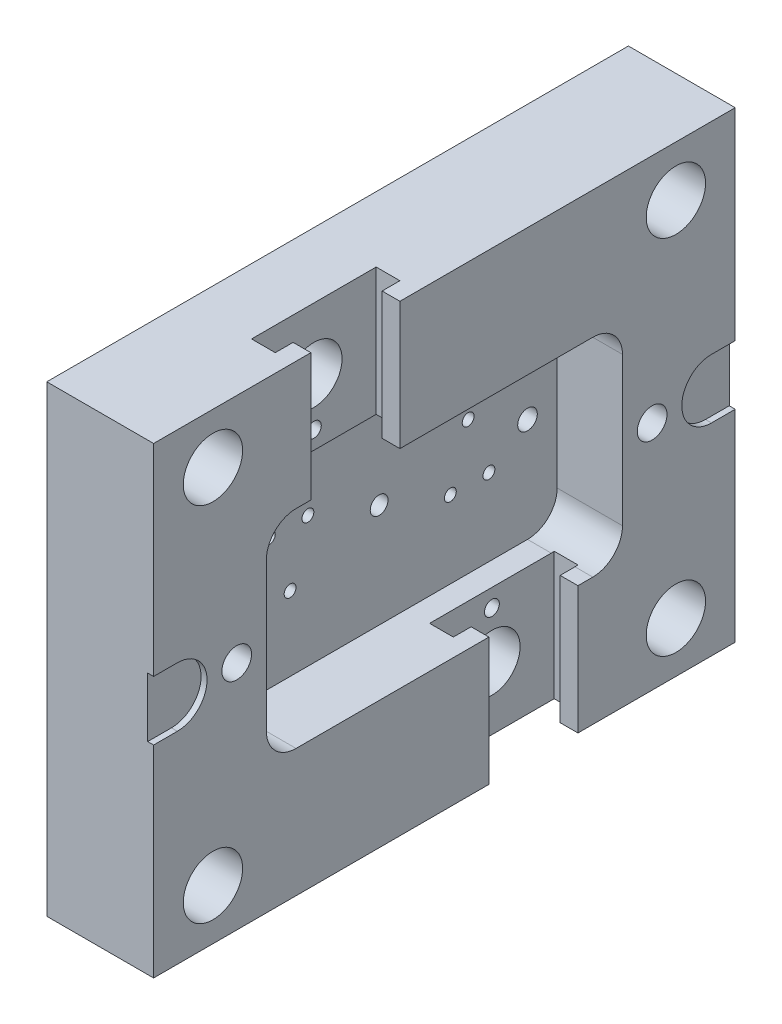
SolidWorks part; units mm, degrees
ref_plane "Face" through (0, 0, 0) normal (0, 0, 1) x (1, 0, 0)
ref_plane "Dessus" through (0, 0, 0) normal (0, 1, 0) x (1, 0, 0)
ref_plane "Droite" through (0, 0, 0) normal (1, 0, 0) x (0, 0, -1)
imported_body "Importée1"
sketch "Esquisse2" plane through (-75, 0, 0) normal (-1, 0, 0) x (0, 0, 1)
  line L0 (0, 156) -> (196, 156) construction
  line L1 (0, 0) -> (0, 156) construction
  circle A0 centre (98, 78) radius 3
  dimension "D1" = 6
  dimension "D2" = 78
  dimension "D3" = 98
extrude "Enlèv. mat.-Extru.1" cut sketch "Esquisse2" against normal through all
sketch "Esquisse1" plane through (-39, 0, 0) normal (-1, 0, 0) x (0, 0, 1)
  line L1 (48, 113) -> (148, 113)
  line L2 (38, 103) -> (38, 53)
  line L3 (48, 43) -> (148, 43)
  line L4 (158, 103) -> (158, 53)
  arc A0 (148, 43) -> (158, 53) centre (148, 53) ccw
  arc A1 (148, 113) -> (158, 103) centre (148, 103) cw
  arc A2 (48, 113) -> (38, 103) centre (48, 103) ccw
  arc A3 (38, 53) -> (48, 43) centre (48, 53) ccw
  circle A4 centre (98, 78) radius 3 construction
  point P8 (158, 113)
  point P11 (38, 113)
  point P14 (38, 43)
  dimension "D3" = 10
  dimension "D1" = 120
  dimension "D2" = 70
  dimension "D4" = 60
  dimension "D5" = 35
extrude "Enlèv. mat.-Extru.2" cut sketch "Esquisse1" along normal blind 22
sketch "Esquisse3" plane through (0, 156, 0) normal (0, 1, 0) x (-1, 0, 0)
  line L0 (39, 143) -> (39, 113)
  line L1 (39, 196) -> (39, 0) construction
  line L2 (39, 143) -> (45, 143)
  line L3 (45, 143) -> (45, 149)
  line L4 (45, 149) -> (53, 149)
  line L5 (53, 149) -> (53, 107)
  line L6 (53, 107) -> (45, 107)
  line L7 (45, 107) -> (45, 113)
  line L8 (45, 113) -> (39, 113)
  line L9 (61, 98) -> (75, 98) construction
  dimension "D1" = 30
  dimension "D2" = 8
  dimension "D3" = 6
  dimension "D4" = 6
  dimension "D5" = 15
extrude "Enlèv. mat.-Extru.3" cut sketch "Esquisse3" against normal up to next
sketch "Esquisse4" plane through (0, 0, 0) normal (0, -1, 0) x (1, 0, 0)
  line L0 (-39, 53) -> (-39, 83)
  line L1 (-39, 0) -> (-39, 196) construction
  line L2 (-39, 83) -> (-45, 83)
  line L3 (-45, 83) -> (-45, 89)
  line L4 (-45, 89) -> (-53, 89)
  line L5 (-53, 89) -> (-53, 47)
  line L6 (-53, 47) -> (-45, 47)
  line L7 (-45, 47) -> (-45, 53)
  line L8 (-45, 53) -> (-39, 53)
  line L9 (-61, 98) -> (-75, 98) construction
  dimension "D1" = 8
  dimension "D2" = 6
  dimension "D3" = 6
  dimension "D4" = 30
  dimension "D5" = 15
extrude "Enlèv. mat.-Extru.4" cut sketch "Esquisse4" against normal up to next
hole_wizard "Trou taraudé M10x1.51" positions "Esquisse6" profile "Esquisse5" tap size "M10x1.5" standard "Ansi Métrique"
sketch "Esquisse6" plane through (-75, 0, 0) normal (-1, 0, 0) x (0, 0, 1)
  point P0 (41, 17)
  point P1 (41, 139)
  point P2 (155, 139)
  point P4 (155, 17)
sketch "Esquisse5" plane through (-75, 17, 41) normal (0, 1, 0) x (0, 0, 1)
  line L0 (0, 0) -> (0, 30.0537)
  line L1 (0, 30.0537) -> (4.25, 27.5)
  line L2 (4.25, 27.5) -> (4.25, 0)
  line L5 (4.25, 0) -> (0, 0)
  line L10 (0, 30.0537) -> (-4.25, 27.5) construction
  line L11 (0, -6.35) -> (0, 107.95) construction
  dimension "Diamètre du trou pour taraudage" = 8.5
  dimension "Profondeur du trou pour taraudage" = 27.5
  dimension "Angle de pointe" = 118
sketch "Esquisse7" plane through (-61, 0, 0) normal (1, 0, 0) x (0, 0, -1)
  circle A0 centre (-135, 87) radius 2
  circle A1 centre (-122, 87) radius 2
  circle A2 centre (-128, 68) radius 2
  circle A3 centre (-68, 88) radius 2
  circle A4 centre (-74, 69) radius 2
  circle A5 centre (-61, 69) radius 2
  dimension "D1" = 4
  dimension "D2" = 10
  dimension "D3" = 9
  dimension "D4" = 24
  dimension "D5" = 10
  dimension "D6" = 9
  dimension "D7" = 37
  dimension "D8" = 30
  dimension "D9" = 9
  dimension "D10" = 24
  dimension "D11" = 30
  dimension "D12" = 37
extrude "Enlèv. mat.-Extru.5" cut sketch "Esquisse7" against normal through all
hole_wizard "Dégagement M101" positions "Esquisse10" profile "Esquisse9" hole size "M10" standard "Ansi Métrique"
sketch "Esquisse10" plane through (0, 0, 0) normal (0, 0, -1) x (-1, 0, 0)
  line L0 (75, 0) -> (75, 156) construction
  line L1 (61, 78) -> (75, 78) construction
  point P0 (68, 98)
  point P5 (68, 58)
  dimension "D1" = 7
  dimension "D2" = 20
  dimension "D3" = 20
sketch "Esquisse9" plane through (-68, 98, 0) normal (1, 0, 0) x (0, 1, 0)
  line L0 (0, 0) -> (0, 122.4034)
  line L1 (0, 122.4034) -> (4, 120)
  line L2 (4, 120) -> (4, 0)
  line L5 (4, 0) -> (0, 0)
  line L10 (0, 122.4034) -> (-4, 120) construction
  line L11 (0, -6.35) -> (0, 107.95) construction
  dimension "Diamètre du perçage" = 8
  dimension "Profondeur du perçage" = 120
  dimension "Angle de pointe" = 118
hole_wizard "Dégagement M102" positions "Esquisse12" profile "Esquisse11" hole size "M10" standard "Ansi Métrique"
sketch "Esquisse12" plane through (0, 0, 0) normal (0, -1, 0) x (1, 0, 0)
  line L0 (-68, 120) -> (-68, 0) construction
  line L1 (-61, 98) -> (-75, 98) construction
  point P0 (-68, 114)
  dimension "D1" = 16
sketch "Esquisse11" plane through (-68, 0, 114) normal (1, 0, 0) x (0, 0, -1)
  line L0 (0, 0) -> (0, 107.4034)
  line L1 (0, 107.4034) -> (4, 105)
  line L2 (4, 105) -> (4, 0)
  line L5 (4, 0) -> (0, 0)
  line L10 (0, 107.4034) -> (-4, 105) construction
  line L11 (0, -6.35) -> (0, 107.95) construction
  dimension "Diamètre du perçage" = 8
  dimension "Profondeur du perçage" = 105
  dimension "Angle de pointe" = 118
sketch "Esquisse17" plane through (-75, 0, 0) normal (-1, 0, 0) x (0, 0, 1)
  circle A0 centre (168, 78) radius 5
  circle A1 centre (28, 78) radius 5
  dimension "D1" = 10
  dimension "D2" = 70
  dimension "D3" = 70
extrude "Enlèv. mat.-Extru.6" cut sketch "Esquisse17" against normal through all
hole_wizard "Chambrage pour vis à tête cylindrique à 6 pans creux (vis CHC) M61" positions "Esquisse19" profile "Esquisse18" counterbore size "M6" standard "ISO"
sketch "Esquisse19" plane through (-75, 0, 0) normal (-1, 0, 0) x (0, 0, 1)
  point P0 (148, 83)
  point P1 (48, 78)
  dimension "D1" = 50
  dimension "D2" = 50
  dimension "D3" = 5
sketch "Esquisse18" plane through (-75, 83, 148) normal (0, 1, 0) x (0, 0, 1)
  line L0 (0, 0) -> (0, 51.9828)
  line L1 (0, 51.9828) -> (3.3, 50)
  line L2 (3.3, 50) -> (3.3, 7)
  line L3 (3.3, 7) -> (5.5, 7)
  line L4 (5.5, 7) -> (5.5, 0)
  line L5 (5.5, 0) -> (0, 0)
  line L10 (0, 51.9828) -> (-3.3, 50) construction
  line L11 (0, -6.35) -> (0, 107.95) construction
  dimension "Diamètre du perçage" = 6.6
  dimension "Profondeur du perçage" = 50
  dimension "Diamètre du chambrage" = 11
  dimension "Profondeur du chambrage" = 7
  dimension "Angle de pointe" = 118
sketch "Esquisse20" plane through (-53, 0, 0) normal (1, 0, 0) x (0, 0, -1)
  line L0 (-83, 43) -> (-83, 0) construction
  line L1 (-113, 113) -> (-113, 156) construction
  line L2 (-89, 0) -> (-47, 0) construction
  line L3 (-107, 156) -> (-149, 156) construction
  circle A0 centre (-68, 21) radius 9.5
  circle A1 centre (-128, 135) radius 9.5
  dimension "D1" = 19
  dimension "D2" = 15
  dimension "D3" = 15
  dimension "D4" = 21
  dimension "D5" = 21
extrude "Enlèv. mat.-Extru.7" cut sketch "Esquisse20" against normal through all
hole_wizard "Trou taraudé M6x1.01" positions "Esquisse22" profile "Esquisse21" tap size "M6x1.0" standard "Ansi Métrique"
sketch "Esquisse22" plane through (-53, 0, 0) normal (1, 0, 0) x (0, 0, -1)
  line L0 (-113, 156) -> (0, 156) construction
  line L1 (-89, 0) -> (-47, 0) construction
  point P0 (-128, 119)
  point P1 (-68, 37)
  dimension "D1" = 37
  dimension "D2" = 37
sketch "Esquisse21" plane through (-53, 119, 128) normal (0, 1, 0) x (0, 0, -1)
  line L0 (0, 0) -> (0, 22)
  line L1 (0, 22) -> (2.5, 22)
  line L2 (2.5, 22) -> (2.5, 0)
  line L5 (2.5, 0) -> (0, 0)
  line L11 (0, -6.35) -> (0, 107.95) construction
  dimension "Diamètre du trou pour taraudage jusqu'au prochain" = 5
  dimension "Profondeur du trou pour taraudage jusqu'au prochain" = 22
sketch "Esquisse23" plane through (-39, 0, 0) normal (1, 0, 0) x (0, 0, -1)
  line L0 (-8, 88) -> (0, 88)
  line L1 (0, 156) -> (0, 0) construction
  line L2 (0, 88) -> (0, 68)
  line L3 (0, 68) -> (-8, 68)
  line L4 (-188, 88) -> (-196, 88)
  line L5 (-196, 0) -> (-196, 156) construction
  line L6 (-196, 88) -> (-196, 68)
  line L7 (-196, 68) -> (-188, 68)
  arc A0 (-8, 88) -> (-8, 68) centre (-8, 78) ccw
  arc A1 (-188, 68) -> (-188, 88) centre (-188, 78) ccw
  dimension "D2" = 10
  dimension "D3" = 10
  dimension "D1" = 8
  dimension "D4" = 8
extrude "Enlèv. mat.-Extru.8" cut sketch "Esquisse23" against normal blind 2
